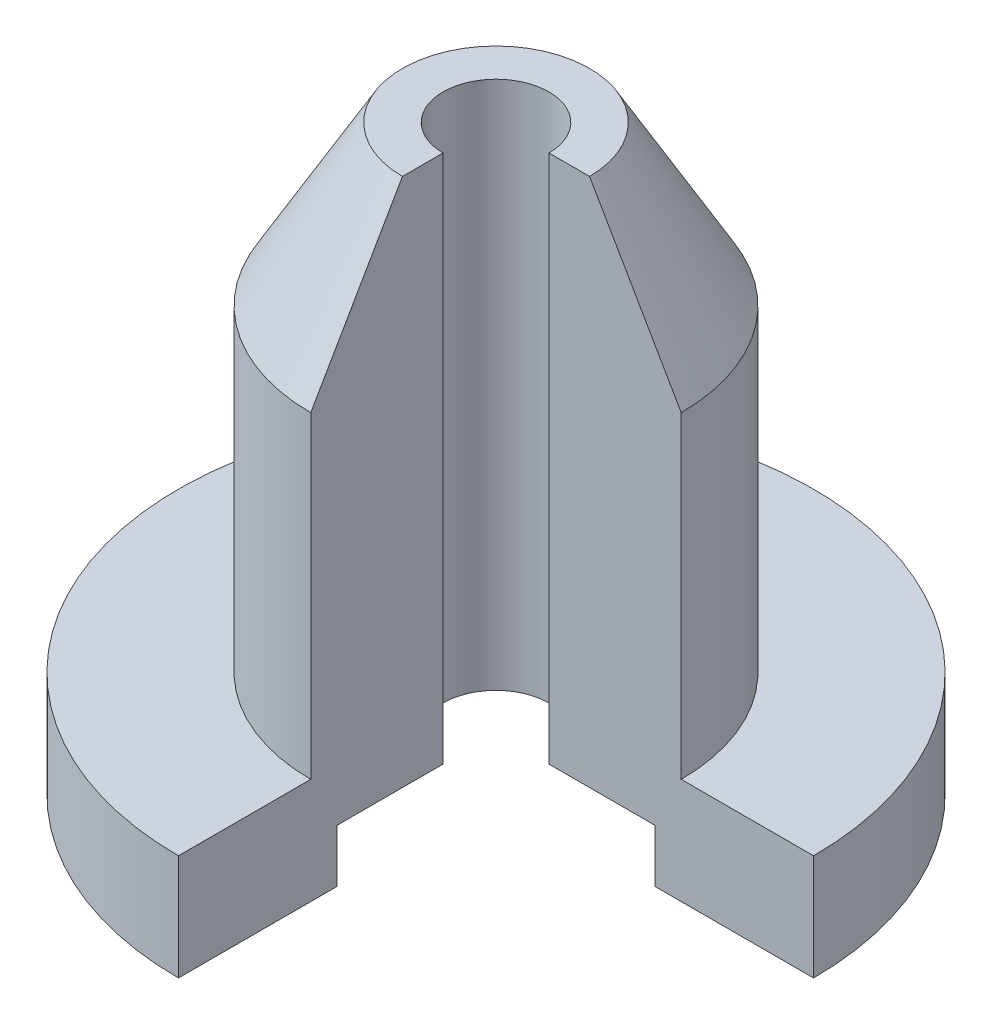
SolidWorks part; units mm, degrees
ref_plane "Front Plane" through (0, 0, 0) normal (0, 0, 1) x (1, 0, 0)
ref_plane "Top Plane" through (0, 0, 0) normal (0, 1, 0) x (1, 0, 0)
ref_plane "Right Plane" through (0, 0, 0) normal (1, 0, 0) x (0, 0, -1)
sketch "Sketch1" plane through (0, 0, 0) normal (0, 0, 1) x (1, 0, 0)
  line L0 (0, 0) -> (0, 53.291) construction
  line L1 (15, 0) -> (15, 5)
  line L2 (15, 5) -> (5, 5)
  line L3 (5, 5) -> (5, 55)
  line L4 (5, 55) -> (8.8397, 55)
  line L5 (8.8397, 55) -> (17.5, 40)
  line L6 (17.5, 40) -> (17.5, 10)
  line L7 (17.5, 10) -> (30, 10)
  line L8 (30, 10) -> (30, 0)
  line L9 (30, 0) -> (15, 0)
  point P11 (6.9199, 55)
  dimension "D1" = 10
  dimension "D2" = 30
  dimension "D3" = 60
  dimension "D4" = 35
  dimension "D5" = 10
  dimension "D6" = 5
  dimension "D7" = 30
  dimension "D8" = 15
  dimension "D9" = 55
revolve "Revolve1" add sketch "Sketch1" angle 270 about L0
